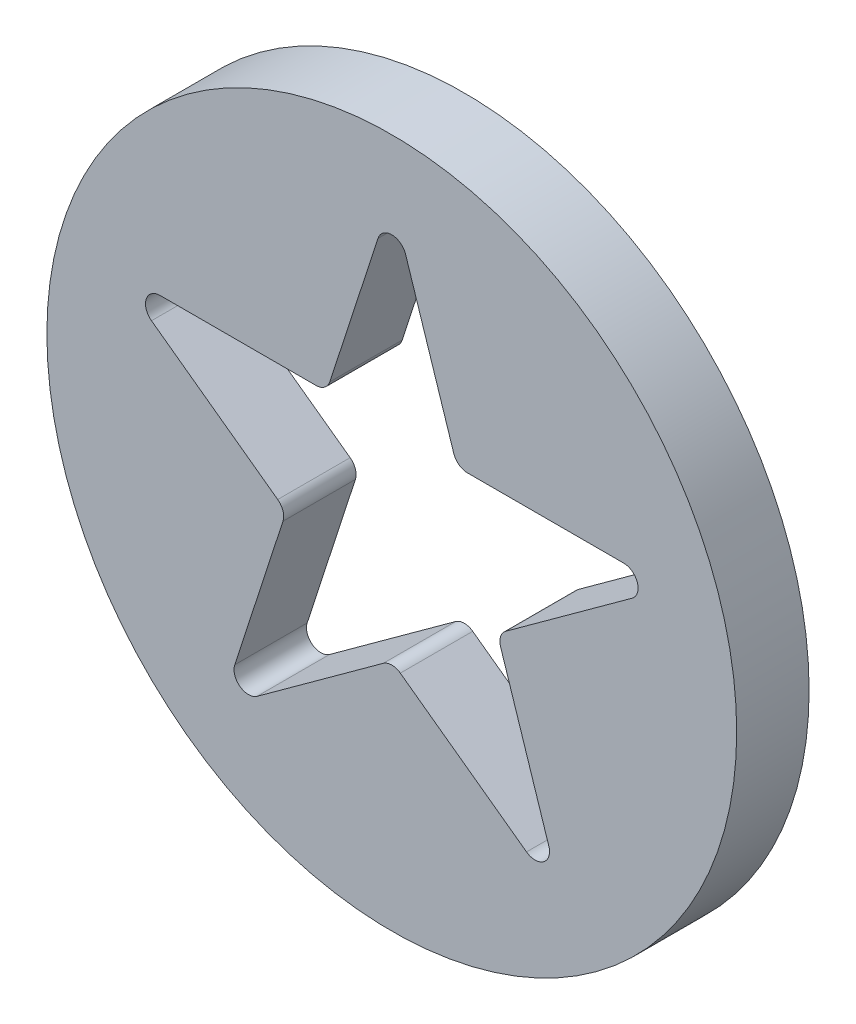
SolidWorks part; units mm, degrees
ref_plane "Front Plane" through (0, 0, 0) normal (0, 0, 1) x (1, 0, 0)
ref_plane "Top Plane" through (0, 0, 0) normal (0, 1, 0) x (1, 0, 0)
ref_plane "Right Plane" through (0, 0, 0) normal (1, 0, 0) x (0, 0, -1)
sketch "Sketch1" plane through (0, 0, 0) normal (0, 0, 1) x (1, 0, 0)
  line L0 (0, 8.025) -> (-4.717, -6.4924)
  line L1 (0, 8.025) -> (-7.6322, 2.4799)
  line L2 (-7.6322, 2.4799) -> (-4.717, -6.4924)
  line L3 (-4.717, -6.4924) -> (4.717, -6.4924)
  line L4 (4.717, -6.4924) -> (7.6322, 2.4799)
  line L5 (7.6322, 2.4799) -> (0, 8.025)
  line L6 (7.6322, 2.4799) -> (-4.717, -6.4924)
  line L7 (0, 8.025) -> (0, 0) construction
  line L8 (-7.6322, 2.4799) -> (7.6322, 2.4799)
  line L9 (-7.6322, 2.4799) -> (4.717, -6.4924)
  line L10 (4.717, -6.4924) -> (0, 8.025)
  circle A0 centre (0, 0) radius 9.525
  circle A1 centre (0, 0) radius 6.4924 construction
  circle A2 centre (0, 0) radius 8.025 construction
  point P3 (0, 7.525)
  point P12 (0, 7.1801)
  dimension "D1" = 19.05
  dimension "D2" = 1.5
extrude "Boss-Extrude1" add sketch "Sketch1" along normal blind 2 contours A0 L5 L4 L3 L2 L1 | L9 L2 L0 | L1 L8 L0 | L10 L8 L5 | L10 L4 L6 | L9 L6 L3
fillet "Fillet1" radius 0.4 5 edges at (-7.6322, 2.4799, 1) (-4.717, -6.4924, 1) (4.717, -6.4924, 1) (7.6322, 2.4799, 1) (0, 8.025, 1)
fillet "Fillet2" radius 0.4 5 edges at (0, -3.0653, 1) (-2.9153, -0.9472, 1) (2.9153, -0.9472, 1) (1.8017, 2.4799, 1) (-1.8017, 2.4799, 1)
